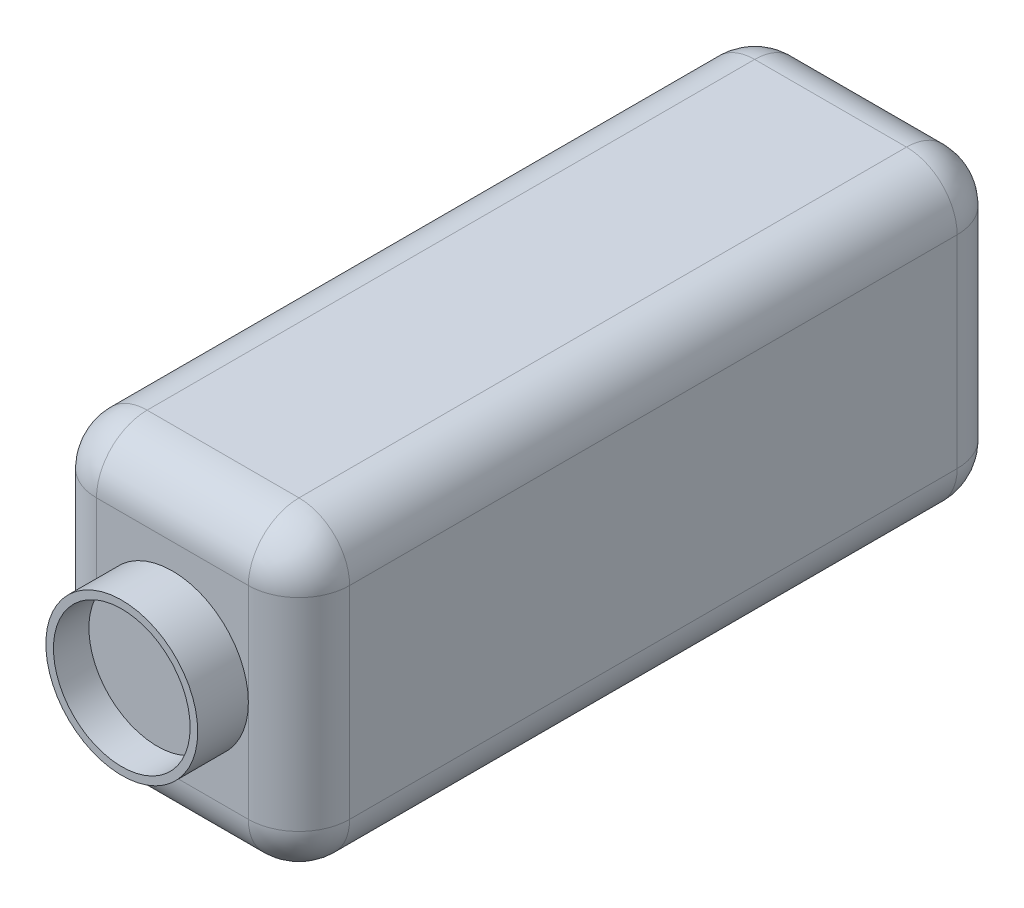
SolidWorks part; units mm, degrees
ref_plane "Alzado" through (0, 0, 0) normal (0, 0, 1) x (1, 0, 0)
ref_plane "Planta" through (0, 0, 0) normal (0, 1, 0) x (1, 0, 0)
ref_plane "Vista lateral" through (0, 0, 0) normal (1, 0, 0) x (0, 0, -1)
sketch "Croquis1" plane through (0, 0, 0) normal (0, 0, 1) x (1, 0, 0)
  circle A0 centre (0, 0) radius 15
  dimension "D1" = 30
extrude "Saliente-Extruir1" add sketch "Croquis1" along normal blind 10
sketch "Croquis2" plane through (0, 0, 10) normal (0, 0, 1) x (1, 0, 0)
  circle A0 centre (0, 0) radius 13.5
  dimension "D1" = 27
extrude "Cortar-Extruir1" cut sketch "Croquis2" against normal offset from surface (7 mm away) 3
sketch "Croquis3" plane through (0, 0, 0) normal (0, 0, -1) x (-1, 0, 0)
  line L1 (-25, 30) -> (25, 30)
  line L2 (-25, 30) -> (-25, -30)
  line L3 (-25, -30) -> (25, -30)
  line L4 (25, 30) -> (25, -30)
  line L5 (-25, 30) -> (25, -30) construction
  line L6 (-25, -30) -> (25, 30) construction
  point P0 (0, 0)
  dimension "D1" = 60
  dimension "D2" = 50
extrude "Saliente-Extruir2" add sketch "Croquis3" along normal blind 140
fillet "Redondeo1" radius 10 12 edges at (-25, 0, 0) (0, 30, 0) (25, 0, 0) (0, -30, 0) (-25, 0, -140) (0, 30, -140) (25, 0, -140) (0, -30, -140) (-25, -30, -70) (25, -30, -70) (-25, 30, -70) (25, 30, -70)
